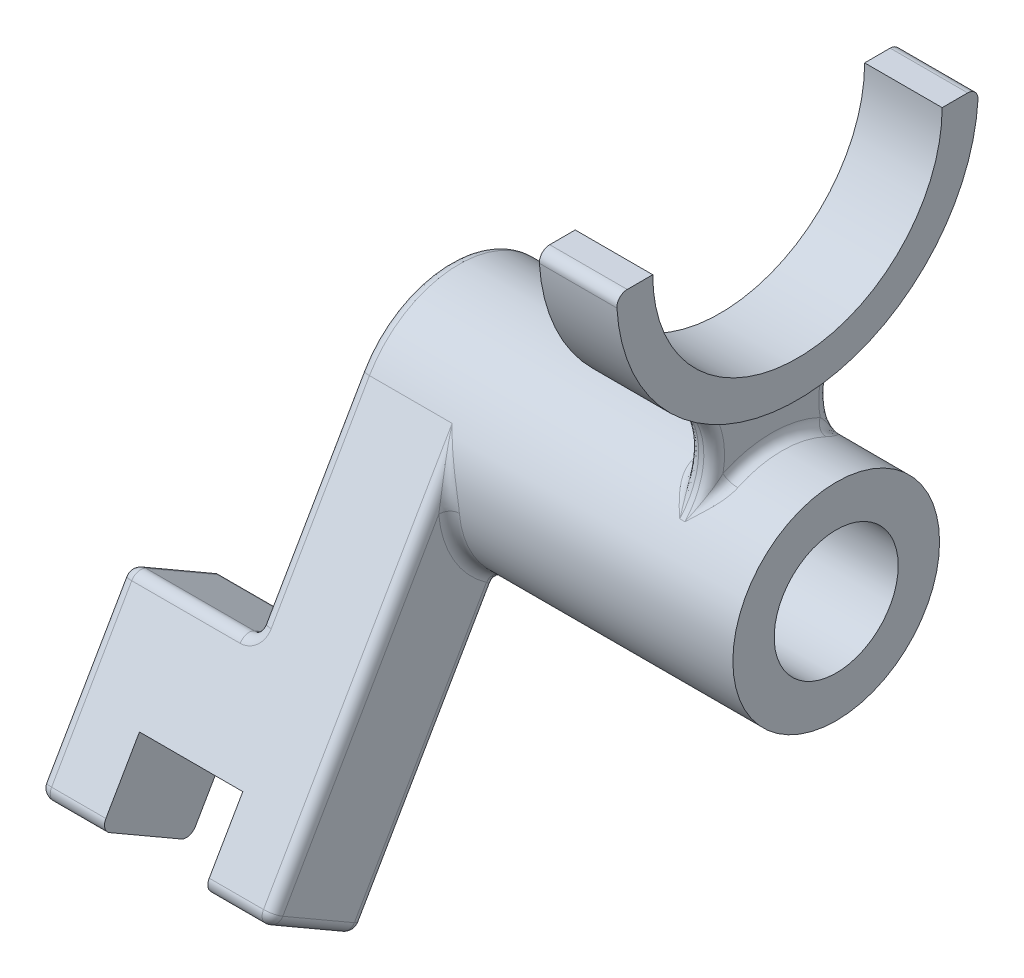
SolidWorks part; units mm, degrees
ref_plane "Front Plane" through (0, 0, 0) normal (0, 0, 1) x (1, 0, 0)
ref_plane "Top Plane" through (0, 0, 0) normal (0, 1, 0) x (1, 0, 0)
ref_plane "Right Plane" through (0, 0, 0) normal (1, 0, 0) x (0, 0, -1)
sketch "Sketch1" plane through (0, 0, 0) normal (-1, 0, 0) x (0, 0, 1)
  line L0 (0, 0) -> (0, -65.9911) construction
  line L1 (0, 0) -> (37.5, -64.9519)
  line L2 (37.5, -64.9519) -> (54.8205, -54.9519)
  line L3 (54.8205, -54.9519) -> (17.3205, 10)
  line L4 (17.3205, 10) -> (0, 0)
  dimension "D1" = 20
  dimension "D2" = 75
  dimension "D3" = 30
extrude "Extrude1" add sketch "Sketch1" along normal blind 45
sketch "Sketch2" plane through (0, 10, 17.3205) normal (0, 0.5, 0.866) x (1, 0, 0)
  line L0 (-20, 0) -> (-20, -40)
  line L1 (-45, 0) -> (0, 0) construction
  line L2 (-20, -40) -> (-45, -40)
  line L3 (-45, -75) -> (-45, 0) construction
  line L4 (-45, -40) -> (-45, 0)
  line L5 (-45, 0) -> (-20, 0)
  line L6 (-22.5, -75) -> (-22.5, -60) construction
  line L7 (-45, -75) -> (0, -75) construction
  line L8 (-12.5, -75) -> (-12.5, -60)
  line L9 (-32.5, -75) -> (-32.5, -60)
  line L10 (-12.5, -75) -> (-32.5, -75)
  line L11 (-12.5, -60) -> (-32.5, -60)
  line L12 (0, -75) -> (0, 0) construction
  dimension "D3" = 15
  dimension "D4" = 40
  dimension "D5" = 20
  dimension "D2" = 10
extrude "Cut-Extrude1" cut sketch "Sketch2" against normal up to next
sketch "Sketch3" plane through (0, 0, 0) normal (0, 0.866, -0.5) x (1, 0, 0)
  line L0 (-20, 0) -> (55, 0)
  line L1 (55, 0) -> (55, -20)
  line L2 (-20, -20) -> (55, -20)
  line L3 (-20, -20) -> (-20, 0)
  line L4 (55, 0) -> (69.4156, 0) construction
  dimension "D2" = 75
revolve "Revolve1" add sketch "Sketch3" angle 360 about L0
ref_plane "Plane1" through (40, 0, 0) normal (1, 0, 0) x (0, 0, -1)
sketch "Sketch9" plane through (40, 0, 0) normal (1, 0, 0) x (0, 0, -1)
  line L0 (-35, 65) -> (35, 65) construction
  line L1 (0, 0) -> (0, 65) construction
  arc A0 (-35, 65) -> (35, 65) centre (0, 65) ccw
  dimension "D1" = 35
  dimension "D2" = 65
extrude "Extrude-Thin1" add sketch "Sketch9" along normal mid plane 15 thin
sketch "Sketch10" plane through (40, 0, 0) normal (1, 0, 0) x (0, 0, -1)
  line L0 (0, 0) -> (0, 65) construction
  circle A0 centre (0, 0) radius 20 construction
  arc A1 (14.7708, 13.4842) -> (-14.7708, 13.4842) centre (0, 0) ccw
  arc A2 (-35, 65) -> (35, 65) centre (0, 65) ccw construction
  arc A3 (-17.936, 34.9451) -> (17.936, 34.9451) centre (0, 65) ccw
  arc A4 (17.936, 34.9451) -> (14.7708, 13.4842) centre (25.1104, 22.9231) ccw
  arc A5 (-17.936, 34.9451) -> (-14.7708, 13.4842) centre (-25.1104, 22.9231) cw
  dimension "D1" = 14
extrude "Extrude2" add sketch "Sketch10" along normal mid plane 5
sketch "Sketch11" plane through (55, 0, 0) normal (1, 0, 0) x (0, 0, -1)
  circle A2 centre (0, 0) radius 12
  circle A3 centre (0, 0) radius 12
  dimension "D1" = 8
extrude "Cut-Extrude2" cut sketch "Sketch11" against normal up to next
fillet "Fillet1" radius 2 26 edges at (-20, 5.1764, -19.3185) (0, -5.1764, 19.3185) (-20, -25.9808, 15) (-20, -7.3205, 27.3205) (-10, -17.3205, 10) (-6.25, -64.9519, 37.5) (-38.75, -64.9519, 37.5) (-20, -29.641, 28.6603) (-32.5, -34.641, 20) (-45, -29.641, 28.6603) (-45, -59.9519, 46.1603) (-38.75, -54.9519, 54.8205) (-6.25, -54.9519, 54.8205) (0, -59.9519, 46.1603) (0, -41.1362, 23.75) (0, -22.476, 36.0705) (-45, -39.7965, 46.0705) (-32.5, -24.641, 37.3205) (37.5, 20, 0) (37.5, 24.9658, -11.2602) (42.5, 24.9658, -11.2602) (37.5, 24.9658, 11.2602) (42.5, 20, 0) (42.5, 24.9658, 11.2602) (40, 65, -35) (40, 65, 35)
